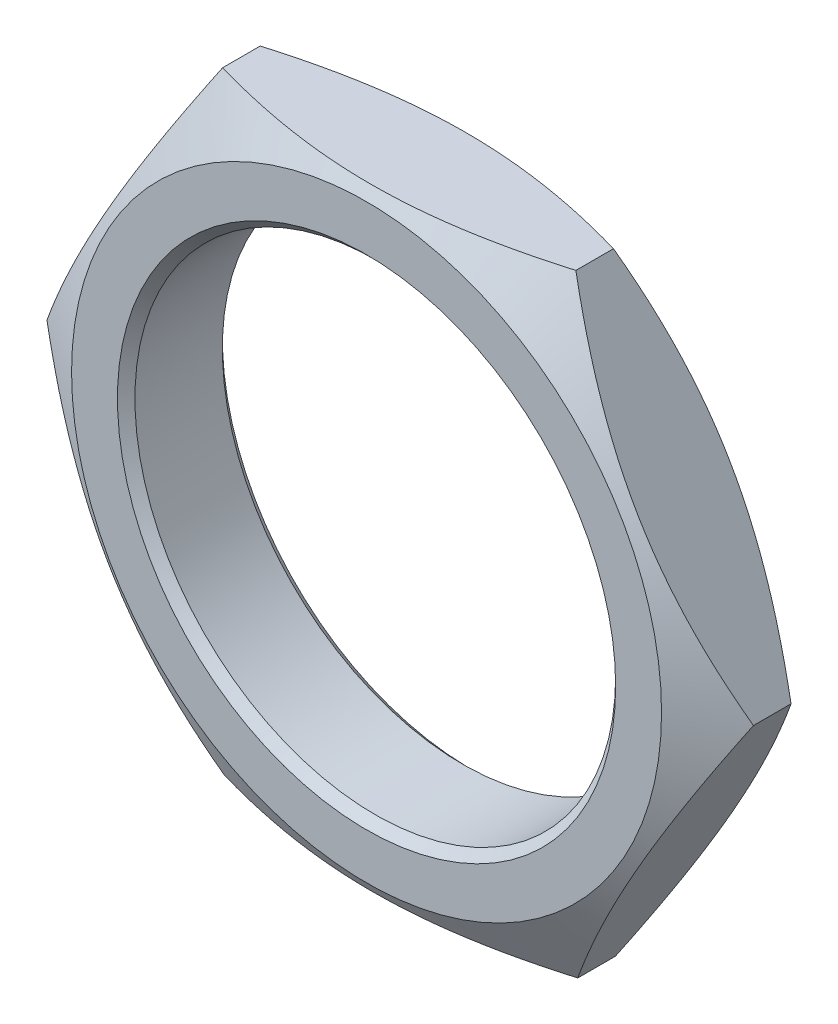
SolidWorks part; units mm, degrees
ref_plane "Plan de face" through (0, 0, 0) normal (0, 0, 1) x (1, 0, 0)
ref_plane "Plan de dessus" through (0, 0, 0) normal (0, 1, 0) x (1, 0, 0)
ref_plane "Plan de droite" through (0, 0, 0) normal (1, 0, 0) x (0, 0, -1)
sketch "Esquisse1" plane through (0, 0, 0) normal (0, 0, 1) x (1, 0, 0)
  line L1 (4.0632, -6.9874) -> (8.0829, 0.0251)
  line L2 (8.0829, 0.0251) -> (4.0197, 7.0125)
  line L3 (4.0197, 7.0125) -> (-4.0632, 6.9874)
  line L4 (-4.0632, 6.9874) -> (-8.0829, -0.0251)
  line L5 (-8.0829, -0.0251) -> (-4.0197, -7.0125)
  line L6 (-4.0197, -7.0125) -> (4.0632, -6.9874)
  circle A0 centre (0, 0) radius 7 construction
  circle A1 centre (0, 0) radius 5.5
  dimension "D2" = 8.0829
  dimension "D3" = 11
  dimension "D1" = 14
extrude "Boss.-Extru.1" add sketch "Esquisse1" along normal blind 2.4
sketch "Esquisse2" plane through (0, 0, 2.4) normal (0, 0, 1) x (1, 0, 0)
  circle A0 centre (0, 0) radius 6.75
  dimension "D1" = 13.5
extrude "Enlèv. mat.-Extru.3" cut sketch "Esquisse2" against normal blind 1 draft 60 flip side to cut
sketch "Esquisse3" plane through (0, 0, 0) normal (0, 0, -1) x (-1, 0, 0)
  circle A0 centre (0, 0) radius 6.75
  dimension "D1" = 13.5
extrude "Enlèv. mat.-Extru.4" cut sketch "Esquisse3" against normal blind 1 draft 60 flip side to cut
chamfer "Chanfrein2" distance 0.2 angle 45 2 edges at (5.5, 0, 2.4) (5.5, 0, 0)
